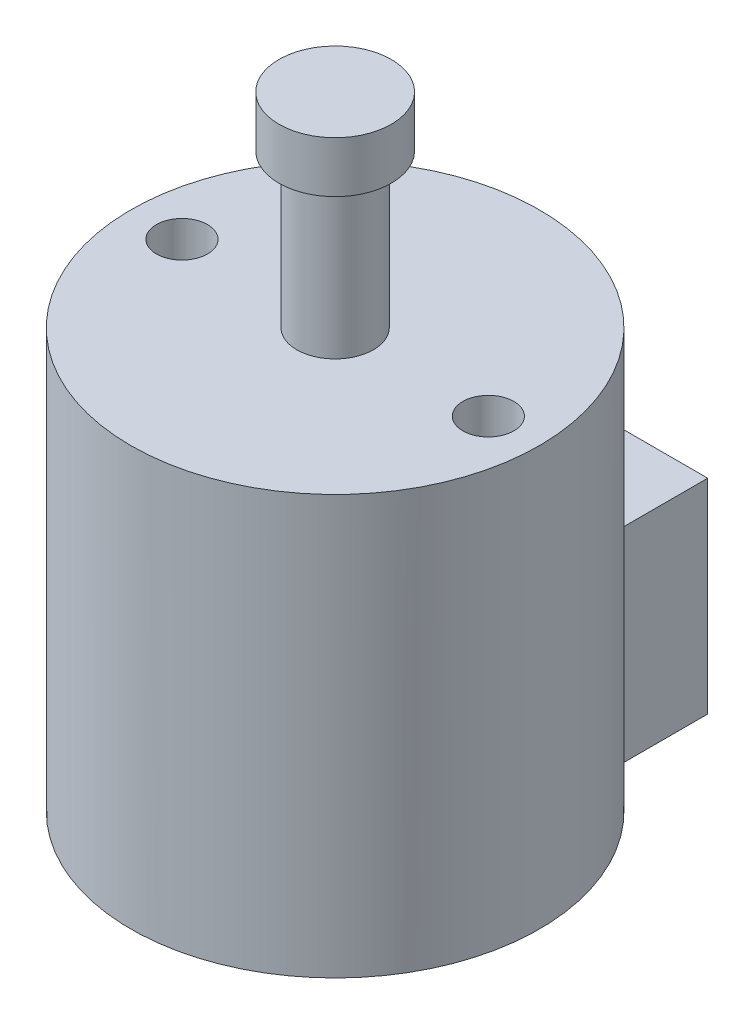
SolidWorks part; units mm, degrees
ref_plane "Front Plane" through (0, 0, 0) normal (0, 0, 1) x (1, 0, 0)
ref_plane "Top Plane" through (0, 0, 0) normal (0, 1, 0) x (1, 0, 0)
ref_plane "Right Plane" through (0, 0, 0) normal (1, 0, 0) x (0, 0, -1)
sketch "Sketch1" plane through (0, 0, 0) normal (0, 1, 0) x (1, 0, 0)
  circle A0 centre (0, 0) radius 4
  dimension "D1" = 8
extrude "Boss-Extrude1" add sketch "Sketch1" along normal blind 8.2
sketch "Sketch2" plane through (0, 0, 0) normal (0, 1, 0) x (1, 0, 0)
  line L0 (0, 0) -> (0, 8.4625) construction
  line L2 (-2, 5.2964) -> (2, 5.2964)
  line L3 (-2, 5.2964) -> (-2, 0)
  line L4 (-2, 0) -> (2, 0)
  line L5 (2, 5.2964) -> (2, 0)
  point P8 (0, 5.2964)
  dimension "D1" = 4
extrude "Boss-Extrude2" add sketch "Sketch2" along normal blind 4
sketch "Sketch3" plane through (0, 0, -5.2964) normal (0, 0, -1) x (-1, 0, 0)
  line L0 (0, 4) -> (0, 0) construction
  line L1 (2, 4) -> (-2, 4) construction
  line L10 (-2, 0) -> (2, 0) construction
  line L19 (-0.175, 2.1682) -> (-0.175, 1.5022)
  line L20 (1.8569, 2.1682) -> (1.191, 2.1682)
  line L21 (1.8569, 2.1682) -> (1.8569, 1.5022)
  line L22 (1.8569, 1.5022) -> (1.191, 1.5022)
  line L23 (1.191, 2.1682) -> (1.191, 1.5022)
  line L24 (0.841, 2.1682) -> (0.175, 2.1682)
  line L25 (0.841, 2.1682) -> (0.841, 1.5022)
  line L26 (0.841, 1.5022) -> (0.175, 1.5022)
  line L27 (0.175, 2.1682) -> (0.175, 1.5022)
  line L28 (-0.841, 1.5022) -> (-0.175, 1.5022)
  line L29 (-0.841, 2.1682) -> (-0.841, 1.5022)
  line L30 (-0.841, 2.1682) -> (-0.175, 2.1682)
  line L31 (-1.191, 2.1682) -> (-1.191, 1.5022)
  line L32 (-1.8569, 1.5022) -> (-1.191, 1.5022)
  line L33 (-1.8569, 2.1682) -> (-1.8569, 1.5022)
  line L34 (-1.8569, 2.1682) -> (-1.191, 2.1682)
  dimension "D1" = 0.35
  dimension "D2" = 0.175
extrude "Boss-Extrude3" add sketch "Sketch3" along normal blind 0.254
fillet "Fillet1" radius 0.2 16 edges at (-1.5239, 1.5022, -5.5504) (-1.191, 1.8352, -5.5504) (-1.5239, 2.1682, -5.5504) (-1.8569, 1.8352, -5.5504) (-0.508, 1.5022, -5.5504) (-0.175, 1.8352, -5.5504) (-0.508, 2.1682, -5.5504) (-0.841, 1.8352, -5.5504) (0.175, 1.8352, -5.5504) (0.508, 1.5022, -5.5504) (0.841, 1.8352, -5.5504) (0.508, 2.1682, -5.5504) (1.191, 1.8352, -5.5504) (1.5239, 1.5022, -5.5504) (1.8569, 1.8352, -5.5504) (1.5239, 2.1682, -5.5504)
sketch "Sketch4" plane through (0, 8.2, 0) normal (0, 1, 0) x (1, 0, 0)
  circle A0 centre (0, 0) radius 0.75
  dimension "D1" = 1.5
extrude "Boss-Extrude4" add sketch "Sketch4" along normal blind 4
sketch "Sketch5" plane through (0, 12.2, 0) normal (0, 1, 0) x (1, 0, 0)
  circle A0 centre (0, 0) radius 1.1
  dimension "D1" = 2.2
extrude "Boss-Extrude5" add sketch "Sketch5" against normal blind 1
sketch "Sketch6" plane through (0, 8.2, 0) normal (0, 1, 0) x (1, 0, 0)
  line L0 (-3, 0) -> (3, 0) construction
  circle A1 centre (3, 0) radius 0.5
  circle A2 centre (-3, 0) radius 0.5
  point P2 (0, -0.1235)
  point P7 (0, 0)
  dimension "D1" = 1
  dimension "D2" = 6
extrude "Cut-Extrude1" cut sketch "Sketch6" against normal blind 2
